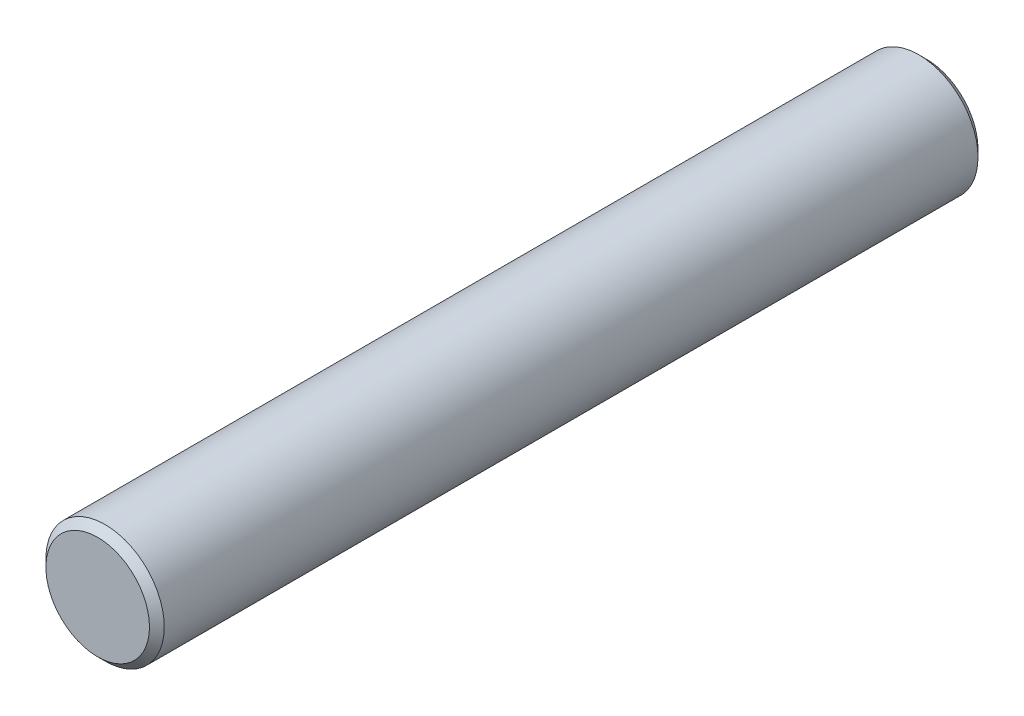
SolidWorks part; units mm, degrees
ref_plane "Plan1" through (0, 0, 0) normal (0, 0, 1) x (1, 0, 0)
ref_plane "Plan2" through (0, 0, 0) normal (0, 1, 0) x (1, 0, 0)
ref_plane "Plan3" through (0, 0, 0) normal (1, 0, 0) x (0, 0, -1)
sketch "Esquisse1" plane through (0, 0, 0) normal (0, 0, 1) x (1, 0, 0)
  circle A0 centre (0, 0) radius 2
  dimension "D1" = 4
extrude "cylindre" add sketch "Esquisse1" along normal blind 28
chamfer "Chanfrein 0.25" distance 0.25 angle 45
